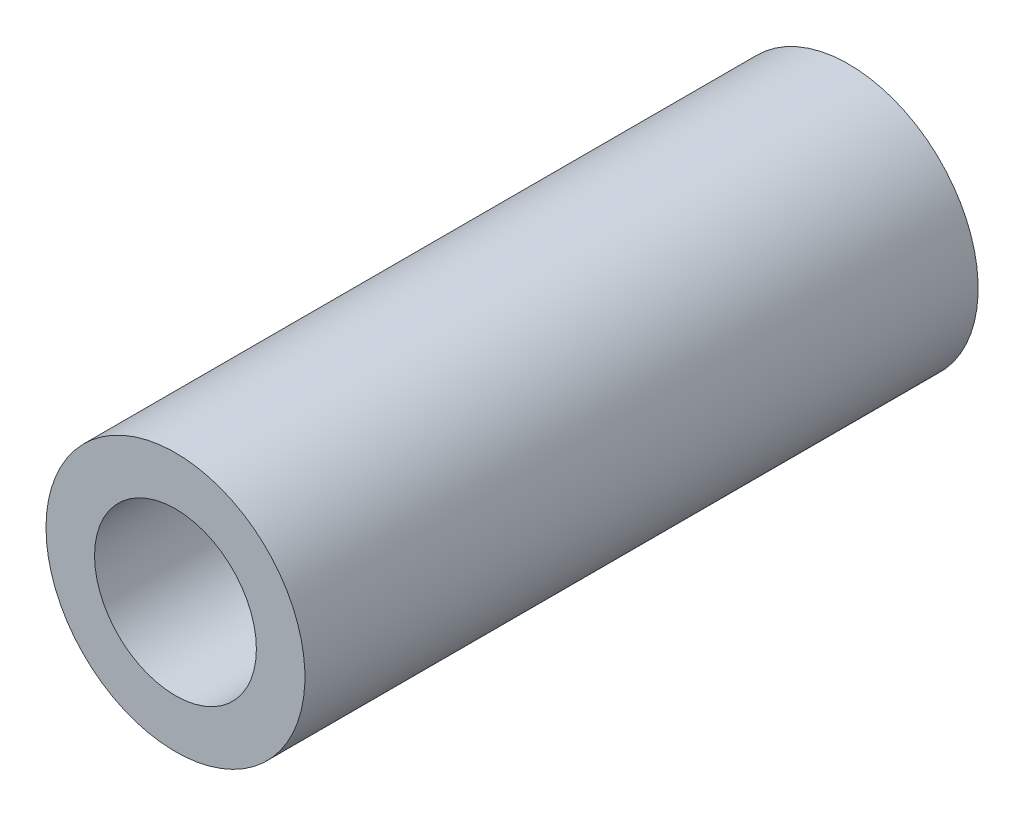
SolidWorks part; units mm, degrees
ref_plane "Front" through (0, 0, 0) normal (0, 0, 1) x (1, 0, 0)
ref_plane "Top" through (0, 0, 0) normal (0, 1, 0) x (1, 0, 0)
ref_plane "Right" through (0, 0, 0) normal (1, 0, 0) x (0, 0, -1)
sketch "Sketch1" plane through (0, 0, 0) normal (0, 0, 1) x (1, 0, 0)
  circle A0 centre (0, 0) radius 1.5875
  circle A1 centre (0, 0) radius 2.54
  dimension "D1" = 3.175
  dimension "D2" = 5.08
extrude "Base-Extrude" add sketch "Sketch1" along normal blind 13.208
